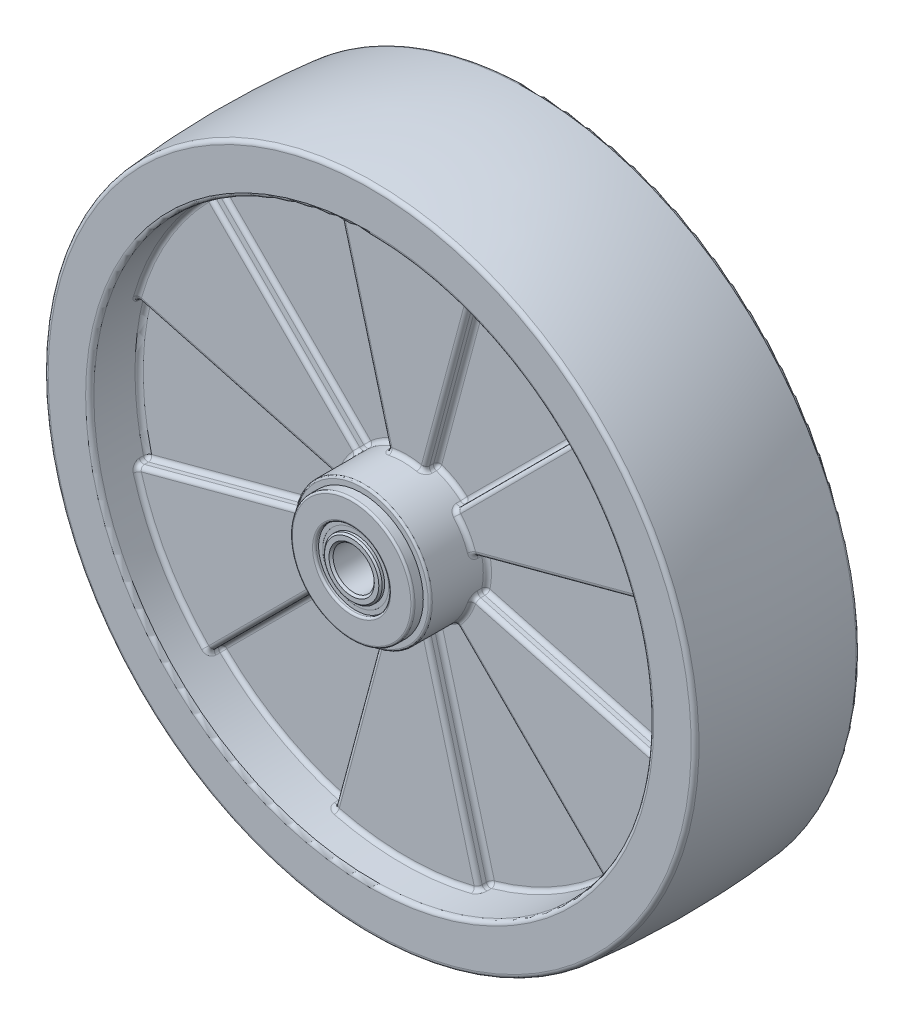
SolidWorks part; units mm, degrees
ref_plane "Front" through (0, 0, 0) normal (0, 0, 1) x (1, 0, 0)
ref_plane "Top" through (0, 0, 0) normal (0, 1, 0) x (1, 0, 0)
ref_plane "Right" through (0, 0, 0) normal (1, 0, 0) x (0, 0, -1)
sketch "Sketch1" plane through (0, 0, 0) normal (1, 0, 0) x (0, 0, -1)
  line L0 (-86.9689, 0) -> (85.6644, 0) construction
  line L1 (-25.4, -85.8228) -> (-9.525, -85.8228) construction
  line L2 (0, 146.7507) -> (0, -181.9168) construction
  line L3 (-9.525, -85.8228) -> (-9.525, 0) construction
  line L4 (9.525, -85.8228) -> (9.525, 0) construction
  line L5 (25.4, -85.8228) -> (9.525, -85.8228) construction
  line L6 (-25.4, -85.8228) -> (-25.4, -100.3268)
  line L8 (25.4, -85.8228) -> (25.4, -100.3268)
  line L9 (-9.525, 0) -> (9.525, 0)
  line L10 (-25.4, -85.8228) -> (-25.4, 0)
  line L11 (-25.4, 0) -> (-9.525, 0)
  line L12 (25.4, -85.8228) -> (25.4, 0)
  line L13 (25.4, 0) -> (9.525, 0)
  line L14 (9.525, 0) -> (9.2507, 0.1021)
  line L15 (-25.4, -100.3268) -> (25.4, -100.3268) construction
  arc A0 (25.4, -100.3268) -> (-25.4, -100.3268) centre (0, 152.4) cw
  point P13 (0, -101.6)
  point P18 (0, -101.6)
  point P21 (0, -100.3268)
  dimension "D2" = 254
  dimension "D1" = 50.8
  dimension "D3" = 101.6
  dimension "D4" = 19.05
  dimension "D5" = 15.7772
revolve "Revolve1" add sketch "Sketch1" angle 360 about L0
chamfer "Chamfer1" [suppressed] distance 1.27 angle 45
sketch "Sketch86" plane through (0, 0, 0) normal (1, 0, 0) x (0, 0, -1)
  line L0 (-25.4, -85.8228) -> (-9.525, -85.8228) construction
  line L1 (-9.525, -85.8228) -> (-9.525, 0) construction
  line L2 (-25.4, 0) -> (-9.525, 0) construction
  line L3 (-25.4, -85.8228) -> (-25.4, 0) construction
  line L4 (9.525, -85.8228) -> (9.525, 0) construction
  line L5 (25.4, 0) -> (9.525, 0) construction
  line L6 (25.4, -85.8228) -> (25.4, 0) construction
  line L7 (25.4, -85.8228) -> (9.525, -85.8228) construction
  line L8 (-25.4, -85.8228) -> (-9.525, -85.8228)
  line L9 (-9.525, -85.8228) -> (-9.525, 0)
  line L10 (-25.4, 0) -> (-9.525, 0)
  line L11 (-25.4, -85.8228) -> (-25.4, 0)
  line L12 (9.525, -85.8228) -> (9.525, 0)
  line L13 (25.4, 0) -> (9.525, 0)
  line L14 (25.4, -85.8228) -> (25.4, 0)
  line L15 (25.4, -85.8228) -> (9.525, -85.8228)
revolve "Cut-Revolve1" cut sketch "Sketch86" angle 360 about L10
sketch "Sketch2" [suppressed] plane through (0, 0, 25.4) normal (0, 0, 1) x (1, 0, 0)
  circle A0 centre (0, 0) radius 31.38
  circle A1 centre (0, 0) radius 25.4978
  circle A3 centre (0, 0) radius 38.492 construction
  circle A4 centre (0, 0) radius 25.4978 construction
  dimension "D1" = 7.112
extrude "Boss-Extrude1" [suppressed] add sketch "Sketch2" along normal blind 0.254
mirror "Mirror1" [suppressed] about plane through (0, 0, 0) normal (0, 0, 1)
sketch "Sketch3" plane through (0, 0, 0) normal (0, 0, 1) x (1, 0, 0)
  circle A0 centre (0, 0) radius 21.082
  dimension "D1" = 42.164
extrude "Boss-Extrude2" add sketch "Sketch3" along normal mid plane 55.5625
sketch "Sketch4" plane through (0, 0, 27.7812) normal (0, 0, 1) x (1, 0, 0)
  circle A0 centre (0, 0) radius 18.923
  dimension "D1" = 37.846
extrude "Boss-Extrude3" add sketch "Sketch4" along normal blind 3.175
mirror "Mirror2" about plane through (0, 0, 0) normal (0, 0, 1) of "Boss-Extrude3"
sketch "Sketch5" [suppressed] plane through (0, 0, 0) normal (0, 1, 0) x (1, 0, 0)
  line L1 (-21.082, -9.525) -> (-21.082, -27.7812) construction
  line L3 (-25.4978, -9.525) -> (-25.4978, -25.654) construction
  line L4 (-25.4978, -9.525) -> (25.4978, -9.525) construction
  arc A0 (-25.4978, -15.875) -> (-21.082, -15.875) centre (-23.2899, -15.5646) cw
  point P9 (-23.2899, -13.335)
  dimension "D1" = 6.35
  dimension "D2" = 3.81
rib "Rib1" [suppressed] sketch "Sketch5" sketch "Sketch5" thickness 6.35 extrusion direction parallel to sketch draft on no parameters "D1"=6.35
fillet "Fillet2" [suppressed] radius 2.032
fillet "Fillet3" [suppressed] radius 1.016
pattern_circular "CirPattern1" [suppressed] count 3 over 360
mirror "Mirror4" [suppressed] about plane through (0, 0, 0) normal (0, 0, 1)
sketch "Sketch6" plane through (0, 0, 0) normal (0, 0, 1) x (1, 0, 0)
  line L0 (0, 0) -> (38.2762, 72.9054) construction
  dimension "D1" = 27.7
ref_plane "Plane1" through (0, 0, 0) normal (0.8854, -0.4648, 0) x (0.4648, 0.8854, 0)
ref_plane "Plane2" through (0, 92.075, 0) normal (0, 1, 0) x (1, 0, 0)
sketch "Sketch26" plane through (0, 0, 0) normal (0, 0, 1) x (1, 0, 0)
  circle A0 centre (0, 0) radius 11.43
  dimension "D1" = 22.86
sketch "Sketch89" plane through (0, 0, 0) normal (0, 1, 0) x (1, 0, 0)
  line L0 (33.02, -9.525) -> (33.02, -12.065)
  line L1 (-85.8228, -9.525) -> (85.8228, -9.525) construction
  line L2 (33.02, -12.065) -> (20.32, -24.765)
  line L3 (20.32, -24.765) -> (20.32, -9.525)
  line L4 (20.32, -9.525) -> (33.02, -9.525)
  dimension "D1" = 12.7
  dimension "D2" = 20.32
  dimension "D3" = 15.24
  dimension "D4" = 45
extrude "Boss-Extrude19" [suppressed] add sketch "Sketch89" along normal mid plane 10.16
sketch "Sketch91" [suppressed] plane through (22.5425, 0, 22.5425) normal (0.7071, 0, 0.7071) x (0.7071, 0, -0.7071)
  circle A0 centre (2.54, 0) radius 1.905
  dimension "D1" = 3.81
  dimension "D2" = 2.54
extrude "Boss-Extrude21" [suppressed] add sketch "Sketch91" along normal blind 3.556
fillet "Fillet12" [suppressed] radius 0.508
fillet "Fillet13" [suppressed] radius 1.27
extrude "Cut-Extrude1" cut sketch "Sketch26" against normal through all both and the other way through all
sketch "Sketch92" [suppressed] plane through (0, 0, 0) normal (0, 1, 0) x (1, 0, 0)
  line L0 (-21.082, -18.6531) -> (-25.4978, -9.525)
  line L1 (-21.082, -9.525) -> (-21.082, -27.7812) construction
  line L2 (-25.4978, -9.525) -> (25.4978, -9.525) construction
rib "Rib2" [suppressed] sketch "Sketch92" sketch "Sketch92" thickness 5.08 extrusion direction parallel to sketch draft on no parameters "D1"=5.08
fillet "Fillet14" [suppressed] radius 0.635
sketch "Sketch93" plane through (0, 0, 25.4) normal (0, 0, 1) x (1, 0, 0)
  circle A0 centre (0, 0) radius 85.8228 construction
  circle A1 centre (0, 0) radius 85.8228
  circle A2 centre (0, 0) radius 21.082 construction
  circle A3 centre (0, 0) radius 21.082
extrude "Boss-Extrude22" add sketch "Sketch93" against normal up to surface (15.875 mm away)
sketch "Sketch94" plane through (0, 0, -25.4) normal (0, 0, -1) x (-1, 0, 0)
  circle A0 centre (0, 0) radius 85.8228 construction
  circle A1 centre (0, 0) radius 85.8228
  circle A2 centre (0, 0) radius 21.082 construction
  circle A3 centre (0, 0) radius 21.082
extrude "Boss-Extrude23" add sketch "Sketch94" against normal up to surface (15.875 mm away)
sketch "Sketch95" plane through (0, 0, 30.9563) normal (0, 0, 1) x (1, 0, 0)
  circle A1 centre (0, 0) radius 8.89
  circle A2 centre (0, 0) radius 6.35
  dimension "D1" = 12.7
  dimension "D2" = 17.78
extrude "Boss-Extrude25" add sketch "Sketch95" against normal up to surface (61.9125 mm away)
ref_plane "Plane3" through (0, 0, 29.6863) normal (0, 0, 1) x (1, 0, 0)
sketch "Sketch99" plane through (0, 0, 29.6863) normal (0, 0, 1) x (1, 0, 0)
  circle A0 centre (0, 0) radius 8.89 construction
  circle A1 centre (0, 0) radius 8.89
  circle A2 centre (0, 0) radius 10.16
  dimension "D1" = 20.32
extrude "Boss-Extrude28" add sketch "Sketch99" against normal up to surface (29.6863 mm away)
sketch "Sketch100" plane through (0, 0, 29.6863) normal (0, 0, 1) x (1, 0, 0)
  circle A0 centre (0, 0) radius 10.16 construction
  circle A1 centre (0, 0) radius 10.16
  circle A2 centre (0, 0) radius 11.43 construction
  circle A3 centre (0, 0) radius 11.43
extrude "Boss-Extrude30" add sketch "Sketch100" against normal blind 29.718 and the other way blind 0.0254
chamfer "Chamfer4" distance 0.508 angle 45 2 edges at (8.89, 0, 30.9563) (-8.89, 0, -30.9563)
mirror "Mirror13" about plane through (0, 0, 0) normal (0, 0, 1) of "Boss-Extrude30", "Boss-Extrude28"
chamfer "Chamfer5" distance 0.635 angle 45 2 edges at (-6.35, 0, -30.9563) (6.35, 0, 30.9563)
fillet "Fillet16" radius 0.635 6 edges at (21.082, 0, 27.7812) (21.082, 0, -27.7812) (11.43, 0, -30.9563) (18.923, 0, -30.9563) (11.43, 0, 30.9563) (18.923, 0, 30.9563)
chamfer "Chamfer2" [suppressed] distance 0.508 angle 45
sketch "Sketch96" plane through (0, 0, 30.9563) normal (0, 0, 1) x (1, 0, 0)
  circle A1 centre (0, 0) radius 9.525
  circle A2 centre (0, 0) radius 11.43
  dimension "D1" = 22.86
  dimension "D2" = 19.05
extrude "Boss-Extrude26" [suppressed] add sketch "Sketch96" along normal blind 0.0254
mirror "Mirror8" [suppressed] about plane through (0, 0, 0) normal (0, 0, 1)
sketch "Sketch97" [suppressed] plane through (0, 0, 30.9563) normal (0, 0, 1) x (1, 0, 0)
  circle A0 centre (0, 0) radius 11.43 construction
  circle A1 centre (0, 0) radius 11.43
  circle A2 centre (0, 0) radius 13.335
  dimension "D1" = 26.67
extrude "Boss-Extrude27" [suppressed] add sketch "Sketch97" along normal blind 0.0279
mirror "Mirror10" [suppressed] about plane through (0, 0, 0) normal (0, 0, 1)
chamfer "Chamfer3" [suppressed] distance 0.635 angle 45
sketch "Sketch101" plane through (0, 0, 0) normal (0, 1, 0) x (1, 0, 0)
  line L0 (0, 0) -> (0, -50000) construction
  line L2 (21.082, -25.4) -> (86.36, -25.4)
  line L3 (21.082, -25.4) -> (21.082, -10.16)
  line L4 (21.082, -10.16) -> (86.36, -10.16)
  line L5 (86.36, -25.4) -> (86.36, -10.16)
  dimension "D1" = 172.72
  dimension "D2" = 15.24
revolve "Cut-Revolve2" cut sketch "Sketch101" angle 360 about L0
mirror "Mirror14" about plane through (0, 0, 0) normal (0, 0, 1) of "Cut-Revolve2"
mirror "Mirror25" about plane through (0, 0, 0) normal (0, 0, 1)
sketch "Sketch102" plane through (0, 0, 10.16) normal (0, 0, 1) x (1, 0, 0)
  line L0 (0, 0) -> (0, 86.36) construction
  line L1 (0, 0) -> (-22.3516, 83.4174) construction
  line L2 (0, 0) -> (22.3516, 83.4174) construction
  line L3 (-22.3516, 83.4174) -> (-5.4564, 20.3636)
  line L4 (22.3516, 83.4174) -> (5.4564, 20.3636)
  circle A0 centre (0, 0) radius 86.36 construction
  arc A1 (22.3516, 83.4174) -> (-22.3516, 83.4174) centre (0, 0) ccw
  circle A2 centre (0, 0) radius 21.082 construction
  arc A3 (5.4564, 20.3636) -> (-5.4564, 20.3636) centre (0, 0) ccw
  dimension "D1" = 30
extrude "Boss-Extrude31" add sketch "Sketch102" along normal blind 3.81
pattern_circular "CirPattern2" count 6 over 360 about axis through (0, 0, 0) along (0, 0, 1) of "Boss-Extrude31"
mirror "Mirror26" about plane through (0, 0, 0) normal (0, 0, 1) of "CirPattern2", "Boss-Extrude31"
fillet "Fillet17" radius 1.27 146 edges at (-86.36, 0, 25.4) (-86.36, 0, -25.4) (43.18, 74.79, 10.16) (10.541, 18.2575, 10.16) (-5.4564, 20.3636, 12.065) (13.904, 51.8905, 10.16) (5.4564, 20.3636, 12.065) (22.3516, 83.4174, 12.065) (-13.904, 51.8905, 10.16) (-22.3516, 83.4174, 12.065) (0, 21.082, 13.97) (13.904, 51.8905, 13.97) (0, 86.36, 13.97) (-13.904, 51.8905, 13.97) (86.36, 0, 10.16) (21.082, 0, 10.16) (14.9072, 14.9072, 12.065) (51.8905, 13.904, 10.16) (20.3636, 5.4564, 12.065) (83.4174, 22.3516, 12.065) (37.9865, 37.9865, 10.16) (61.0657, 61.0657, 12.065) (18.2575, 10.541, 13.97) (51.8905, 13.904, 13.97) (74.79, 43.18, 13.97) (37.9865, 37.9865, 13.97) (43.18, -74.79, 10.16) (10.541, -18.2575, 10.16) (20.3636, -5.4564, 12.065) (37.9865, -37.9865, 10.16) (14.9072, -14.9072, 12.065) (61.0657, -61.0657, 12.065) (51.8905, -13.904, 10.16) (83.4174, -22.3516, 12.065) (18.2575, -10.541, 13.97) (37.9865, -37.9865, 13.97) (74.79, -43.18, 13.97) (51.8905, -13.904, 13.97) (-43.18, -74.79, 10.16) (-10.541, -18.2575, 10.16) (5.4564, -20.3636, 12.065) (-13.904, -51.8905, 10.16) (-5.4564, -20.3636, 12.065) (-22.3516, -83.4174, 12.065) (13.904, -51.8905, 10.16) (22.3516, -83.4174, 12.065) (0, -21.082, 13.97) (-13.904, -51.8905, 13.97) (0, -86.36, 13.97) (13.904, -51.8905, 13.97) (-86.36, 0, 10.16) (-21.082, 0, 10.16) (-14.9072, -14.9072, 12.065) (-51.8905, -13.904, 10.16) (-20.3636, -5.4564, 12.065) (-83.4174, -22.3516, 12.065) (-37.9865, -37.9865, 10.16) (-61.0657, -61.0657, 12.065) (-18.2575, -10.541, 13.97) (-51.8905, -13.904, 13.97) (-74.79, -43.18, 13.97) (-37.9865, -37.9865, 13.97) (-43.18, 74.79, 10.16) (-10.541, 18.2575, 10.16) (-20.3636, 5.4564, 12.065) (-37.9865, 37.9865, 10.16) (-14.9072, 14.9072, 12.065) (-61.0657, 61.0657, 12.065) (-51.8905, 13.904, 10.16) (-83.4174, 22.3516, 12.065) (-18.2575, 10.541, 13.97) (-37.9865, 37.9865, 13.97) (-74.79, 43.18, 13.97) (-51.8905, 13.904, 13.97) (43.18, 74.79, -10.16) (10.541, 18.2575, -10.16) (0, 21.082, -13.97) (5.4564, 20.3636, -12.065) (-13.904, 51.8905, -13.97) (-5.4564, 20.3636, -12.065) (0, 86.36, -13.97) (-22.3516, 83.4174, -12.065) (13.904, 51.8905, -13.97) (22.3516, 83.4174, -12.065) (13.904, 51.8905, -10.16) (-13.904, 51.8905, -10.16) (86.36, 0, -10.16) (21.082, 0, -10.16) (18.2575, 10.541, -13.97) (20.3636, 5.4564, -12.065) (37.9865, 37.9865, -13.97) (14.9072, 14.9072, -12.065) (74.79, 43.18, -13.97) (61.0657, 61.0657, -12.065) (51.8905, 13.904, -13.97) (83.4174, 22.3516, -12.065) (51.8905, 13.904, -10.16) (37.9865, 37.9865, -10.16) (43.18, -74.79, -10.16) (10.541, -18.2575, -10.16) (18.2575, -10.541, -13.97) (14.9072, -14.9072, -12.065) (51.8905, -13.904, -13.97) (20.3636, -5.4564, -12.065) (74.79, -43.18, -13.97) (83.4174, -22.3516, -12.065) (37.9865, -37.9865, -13.97) (61.0657, -61.0657, -12.065) (37.9865, -37.9865, -10.16) (51.8905, -13.904, -10.16) (-43.18, -74.79, -10.16) (-10.541, -18.2575, -10.16) (0, -21.082, -13.97) (-5.4564, -20.3636, -12.065) (13.904, -51.8905, -13.97) (5.4564, -20.3636, -12.065) (0, -86.36, -13.97) (22.3516, -83.4174, -12.065) (-13.904, -51.8905, -13.97) (-22.3516, -83.4174, -12.065) (-13.904, -51.8905, -10.16) (13.904, -51.8905, -10.16) (-86.36, 0, -10.16) (-21.082, 0, -10.16) (-18.2575, -10.541, -13.97) (-20.3636, -5.4564, -12.065) (-37.9865, -37.9865, -13.97) (-14.9072, -14.9072, -12.065) (-74.79, -43.18, -13.97) (-61.0657, -61.0657, -12.065) (-51.8905, -13.904, -13.97) (-83.4174, -22.3516, -12.065) (-51.8905, -13.904, -10.16) (-37.9865, -37.9865, -10.16) (-43.18, 74.79, -10.16) (-10.541, 18.2575, -10.16) (-18.2575, 10.541, -13.97) (-14.9072, 14.9072, -12.065) (-51.8905, 13.904, -13.97) (-20.3636, 5.4564, -12.065) (-74.79, 43.18, -13.97) (-83.4174, 22.3516, -12.065) (-37.9865, 37.9865, -13.97) (-61.0657, 61.0657, -12.065) (-37.9865, 37.9865, -10.16) (-51.8905, 13.904, -10.16)
fillet "Fillet18" radius 1.27 2 edges at (100.3268, 0, -25.4) (100.3268, 0, 25.4)
